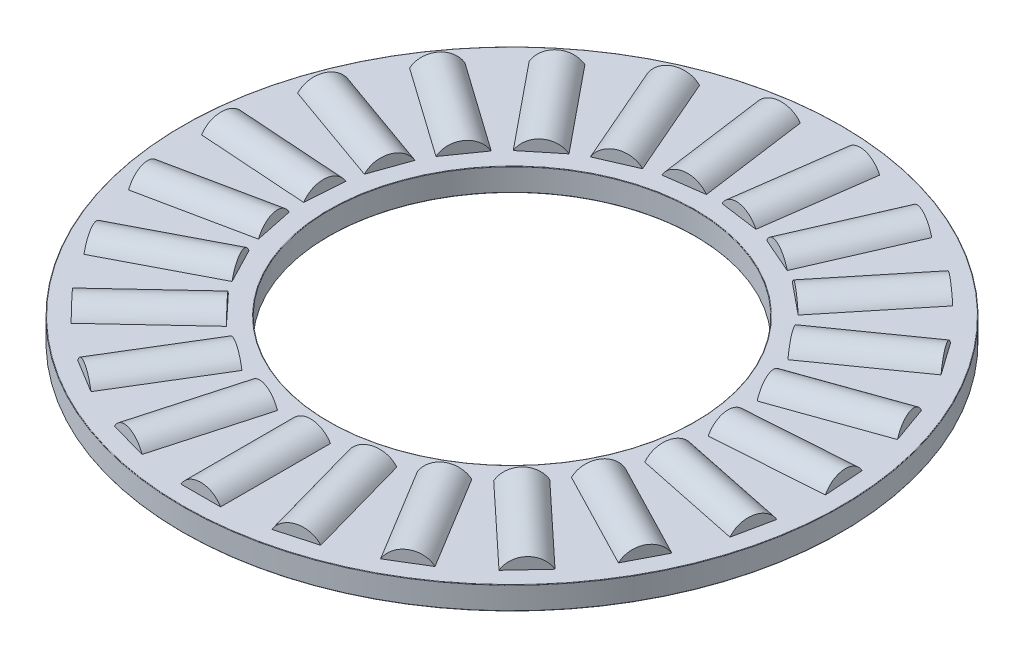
SolidWorks part; units mm, degrees
ref_plane "Front Plane" through (0, 0, 0) normal (0, 0, 1) x (1, 0, 0)
ref_plane "Top Plane" through (0, 0, 0) normal (0, 1, 0) x (1, 0, 0)
ref_plane "Right Plane" through (0, 0, 0) normal (1, 0, 0) x (0, 0, -1)
sketch "Sketch1" plane through (0, 0, 0) normal (1, 0, 0) x (0, 0, -1)
  line L0 (-14.2875, 0) -> (14.2875, 0) construction
  line L1 (0, -0.9922) -> (0, 0.9922) construction
  line L2 (-14.2875, 0.4961) -> (-7.9375, 0.4961)
  line L3 (-14.2875, 0.4961) -> (-14.2875, -0.4961)
  line L4 (-14.2875, -0.4961) -> (-7.9375, -0.4961)
  line L5 (-7.9375, 0.4961) -> (-7.9375, -0.4961)
  line L7 (-11.1125, 0.9922) -> (-11.1125, 0.4961) construction
  line L8 (-13.4938, 0.9922) -> (-8.7312, 0.9922) construction
  line L9 (-13.4938, 0.9922) -> (-13.4938, -0.9922) construction
  line L10 (-13.4938, -0.9922) -> (-8.7312, -0.9922) construction
  line L11 (-8.7312, 0.9922) -> (-8.7312, -0.9922) construction
  point P16 (-13.4938, 0)
  dimension "D1" = 4.7625
  dimension "OD" = 28.575
  dimension "Shaft Dia" = 15.875
  dimension "Th" = 1.9844
  dimension "D2" = 0.9922
  dimension "D3" = 6.35
revolve "Revolve1" add sketch "Sketch1" angle 360 about L1
sketch "Sketch3" plane through (0, 0, 0) normal (1, 0, 0) x (0, 0, -1)
  line L0 (-13.4938, 0.9922) -> (-13.4938, -0.9922) construction
  line L1 (-13.4938, 0) -> (-8.7312, 0)
  line L2 (-13.4938, 0) -> (-13.4938, 0.9922)
  line L3 (-13.4938, 0.9922) -> (-8.7312, 0.9922)
  line L4 (-8.7312, 0) -> (-8.7312, 0.9922)
revolve "Cut-Revolve1" cut sketch "Sketch3" angle 360 about L1
sketch "Sketch2" plane through (0, 0, 0) normal (1, 0, 0) x (0, 0, -1)
  line L1 (-13.4938, 0) -> (-8.7312, 0)
  line L2 (-13.4938, 0) -> (-13.4938, 0.9922)
  line L3 (-13.4938, 0.9922) -> (-8.7312, 0.9922)
  line L4 (-8.7312, 0) -> (-8.7312, 0.9922)
revolve "Revolve2" add sketch "Sketch2" angle 360 about L1
ref_axis "Axis1" through (0, 0.9922, 0) along (0, -1, 0)
pattern_circular "CirPattern1" count 23 every 15.652 about axis through (0, 0.9922, 0) along (0, -1, 0)
pattern_circular "CirPattern2" count 23 every 15.652 about axis through (0, 0, 0) along (0, 1, 0) of "Cut-Revolve1"
sketch "Sketch4" plane through (0, 0, 0) normal (1, 0, 0) x (0, 0, -1)
  line L0 (-14.2875, 0.4961) -> (-14.2875, -0.4961) construction
  line L1 (-14.2875, 9.1091) -> (-7.9375, 9.1091)
  line L2 (-14.2875, 9.1091) -> (-14.2875, 9.9219)
  line L3 (-14.2875, 9.9219) -> (-7.9375, 9.9219)
  line L4 (-7.9375, 9.1091) -> (-7.9375, 9.9219)
  line L5 (-14.2875, -9.9219) -> (-7.9375, -9.9219)
  line L6 (-14.2875, -9.9219) -> (-14.2875, -9.1091)
  line L7 (-14.2875, -9.1091) -> (-7.9375, -9.1091)
  line L8 (-7.9375, -9.9219) -> (-7.9375, -9.1091)
  line L10 (-7.9375, 0.4961) -> (-7.9375, -0.4961) construction
  line L11 (0, 0) -> (-14.2875, 0) construction
  line L12 (-14.2875, 0) -> (14.2875, 0) construction
  line L13 (0, -0.9922) -> (0, 0.9922) construction
  dimension "Ht" = 19.8438
  dimension "Washer Th" = 0.8128
  dimension "Washer ID" = 15.875
  dimension "Washer OD" = 28.575
revolve "Revolve3" [suppressed] add sketch "Sketch4" angle 360 about L1
fillet "Fillet1" [suppressed] radius 0.0198
fillet "Fillet2" radius 0.0198 4 edges at (0, -0.4961, -7.9375) (0, 0.4961, -7.9375) (0, -0.4961, -14.2875) (0, 0.4961, -14.2875)
fillet "Fillet3" [suppressed] radius 0.0198
equation "\"D2@Sketch1\" = \"Th@Sketch1\"*.5"
equation "\"D1@Fillet1\" = \"Th@Sketch1\"*.01"
equation "\"D1@Fillet2\" = \"D1@Fillet1\""
equation "\"D1@Fillet3\" = \"D1@Fillet1\""
equation "\"D1@Sketch1\" = \"D3@Sketch1\"*.75"
equation "\"Angle@CirPattern1\" = 360/\"Rollers@CirPattern1\""
equation "\"Rollers@CirPattern1\" = \"OD@Sketch1\"*20"
equation "\"D1@CirPattern2\" = \"Rollers@CirPattern1\""
equation "\"D2@CirPattern2\" = \"Angle@CirPattern1\""
equation "\"Ht@Sketch4\" = \"Th@Sketch1\"*10"
